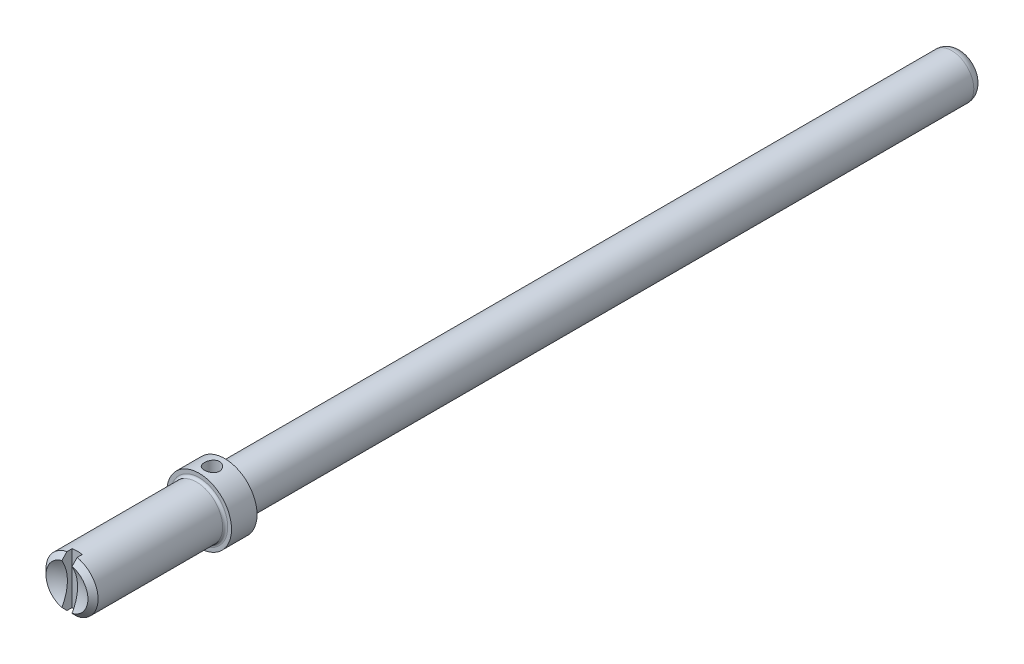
SolidWorks part; units mm, degrees
ref_plane "Спереди" through (0, 0, 0) normal (0, 0, 1) x (1, 0, 0)
ref_plane "Сверху" through (0, 0, 0) normal (0, 1, 0) x (1, 0, 0)
ref_plane "Справа" through (0, 0, 0) normal (1, 0, 0) x (0, 0, -1)
sketch "Эскиз1" plane through (0, 0, 0) normal (1, 0, 0) x (0, 0, -1)
  line L0 (-11.6874, 0) -> (131.5633, 0) construction
  line L1 (138.7932, 0) -> (0, 0)
  line L2 (-0.9068, 3.2702) -> (-0.1131, 4.064)
  line L3 (-0.1131, 4.064) -> (19.3338, 4.064)
  line L4 (19.7307, 4.4609) -> (19.7307, 5.0546)
  line L5 (19.7307, 5.0546) -> (23.7185, 5.0546)
  line L6 (23.7185, 5.0546) -> (23.7185, 3.8513)
  line L7 (24.1153, 3.4544) -> (137.2057, 3.4544)
  line L8 (138.7932, 1.8669) -> (138.7932, 0)
  arc A0 (0, 0) -> (-0.9068, 3.2702) centre (-6.35, 0) ccw
  arc A1 (137.2057, 3.4544) -> (138.7932, 1.8669) centre (137.2057, 1.8669) cw
  arc A2 (23.7185, 3.8513) -> (24.1153, 3.4544) centre (24.1153, 3.8513) ccw
  arc A3 (19.3338, 4.064) -> (19.7307, 4.4609) centre (19.3338, 4.4609) ccw
  dimension "D3" = 6.35
  dimension "D10" = 1.5875
  dimension "D11" = 0.3969
  dimension "D1" = 45
  dimension "D2" = 0.7937
  dimension "D4" = 8.128
  dimension "D5" = 6.9088
  dimension "D6" = 10.1092
  dimension "D7" = 3.9878
  dimension "D8" = 20.6375
  dimension "D9" = 139.7
revolve "Повернуть1" add sketch "Эскиз1" angle 360 about L0
sketch "Эскиз2" plane through (0, 0, 0) normal (0, 1, 0) x (1, 0, 0)
  line L0 (3.2702, -0.9068) -> (-3.2702, -0.9068) construction
  line L1 (-0.7937, 0.6807) -> (0.7937, 0.6807)
  line L2 (-0.7937, 0.6807) -> (-0.7938, -0.9068)
  line L3 (-0.7938, -0.9068) -> (0.7938, -0.9068)
  line L4 (0.7937, 0.6807) -> (0.7938, -0.9068)
  line L5 (0, -4.377) -> (0, 35.247) construction
  line L6 (5.0546, 23.7185) -> (-5.0546, 23.7185) construction
  circle A0 centre (0, 21.7246) radius 1.1811
  dimension "D1" = 2.3622
  dimension "D2" = 1.5875
  dimension "D3" = 1.5875
  dimension "D4" = 1.9939
extrude "Вырез-Вытянуть1" cut sketch "Эскиз2" against normal mid plane 22.86
